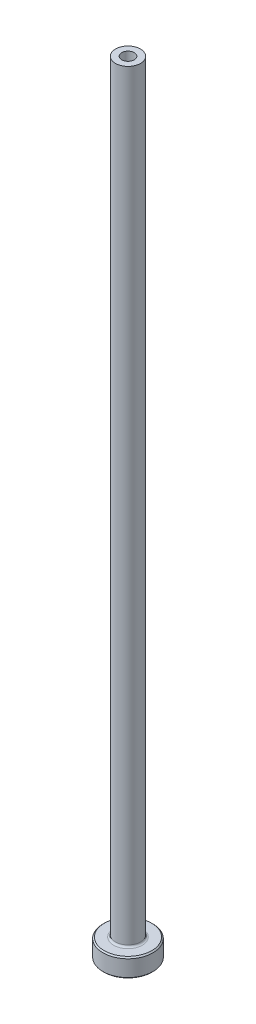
SolidWorks part; units mm, degrees
ref_plane "Front Plane" through (0, 0, 0) normal (0, 0, 1) x (1, 0, 0)
ref_plane "Top Plane" through (0, 0, 0) normal (0, 1, 0) x (1, 0, 0)
ref_plane "Right Plane" through (0, 0, 0) normal (1, 0, 0) x (0, 0, -1)
sketch "Sketch1" plane through (0, 0, 0) normal (0, 0, 1) x (1, 0, 0)
  line L0 (-1, 125) -> (-2, 125)
  line L1 (-2, 125) -> (-2, 3)
  line L2 (-2, 3) -> (-4, 3)
  line L3 (-4, 3) -> (-4, 0)
  line L4 (4.4, 0) -> (-4.4, 0) construction
  line L5 (-4, 0) -> (-1.25, 0)
  line L6 (-1, 90) -> (-1, 125)
  line L7 (0, 92.1877) -> (0, -15.5353) construction
  line L8 (0, -4.4) -> (0, 4.4) construction
  line L9 (-1, 90) -> (-1.25, 78)
  line L10 (-1.25, 78) -> (-1.25, 0)
  dimension "D1" = 0.25
  dimension "ID" = 2
  dimension "OD" = 4
  dimension "L" = 125
  dimension "H" = 8
  dimension "T" = 3
  dimension "N" = 35
  dimension "D2" = 12
revolve "Revolve1" add sketch "Sketch1" angle 360 about L7
fillet "Fillet1" radius 0.3 1 edges at (0, 3, 2)
chamfer "Chamfer1" distance 0.2 angle 45 2 edges at (0, 3, 4) (0, 0, 4)
chamfer "Chamfer3" distance 0.5 angle 45 1 edges at (0, 0, 1.25)
